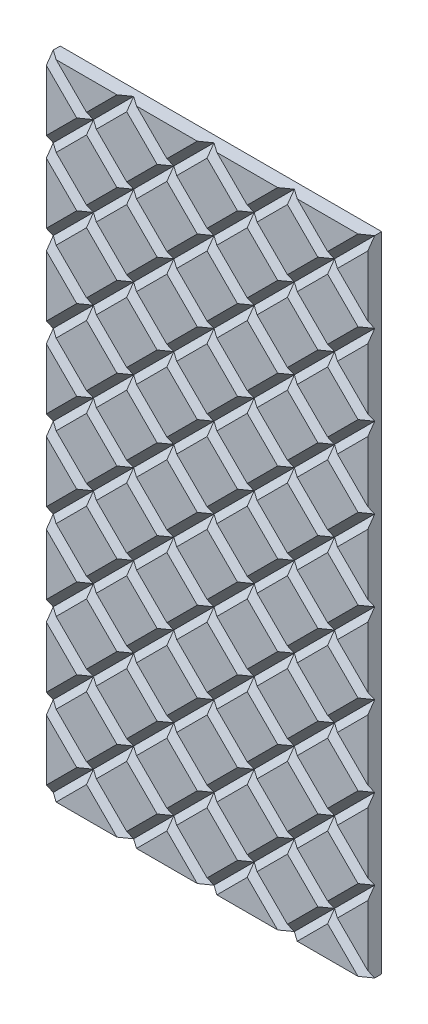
SolidWorks part; units mm, degrees
ref_plane "Front Plane" through (0, 0, 0) normal (0, 0, 1) x (1, 0, 0)
ref_plane "Top Plane" through (0, 0, 0) normal (0, 1, 0) x (1, 0, 0)
ref_plane "Right Plane" through (0, 0, 0) normal (1, 0, 0) x (0, 0, -1)
sketch "Sketch1" plane through (0, 0, 0) normal (0, 0, 1) x (1, 0, 0)
  line L1 (-290, 580) -> (290, 580)
  line L2 (-290, 580) -> (-290, -580)
  line L3 (-290, -580) -> (290, -580)
  line L4 (290, 580) -> (290, -580)
  point P4 (-290, 0)
  point P6 (0, 580)
  dimension "D1" = 580
  dimension "D2" = 1160
extrude "Boss-Extrude1" add sketch "Sketch1" along normal blind 25
ref_plane "Plane1" through (-435, -435, 0) normal (-0.7071, -0.7071, 0) x (0, 0, -1)
sketch "Sketch6" plane through (-435, -435, 0) normal (-0.7071, -0.7071, 0) x (0, 0, -1)
  line L0 (-12.5, 205.061) -> (-39.8765, 177.6845)
  line L1 (-25, 205.061) -> (0, 205.061) construction
  line L2 (-39.8765, 177.6845) -> (-39.8765, 232.4375)
  line L3 (-39.8765, 232.4375) -> (-12.5, 205.061)
  point P4 (0, 0)
  dimension "D1" = 90
  dimension "D2" = 54.753
extrude "Cut-Extrude3" cut sketch "Sketch6" against normal through all
pattern_linear "LPattern3" count 4 spacing 145 along (0.7071, -0.7071, 0) count 8 spacing 145 along (-0.7071, 0.7071, 0) of "Cut-Extrude3"
mirror "Mirror2" about plane through (0, 0, 0) normal (1, 0, 0) of "LPattern3", "Cut-Extrude3"
